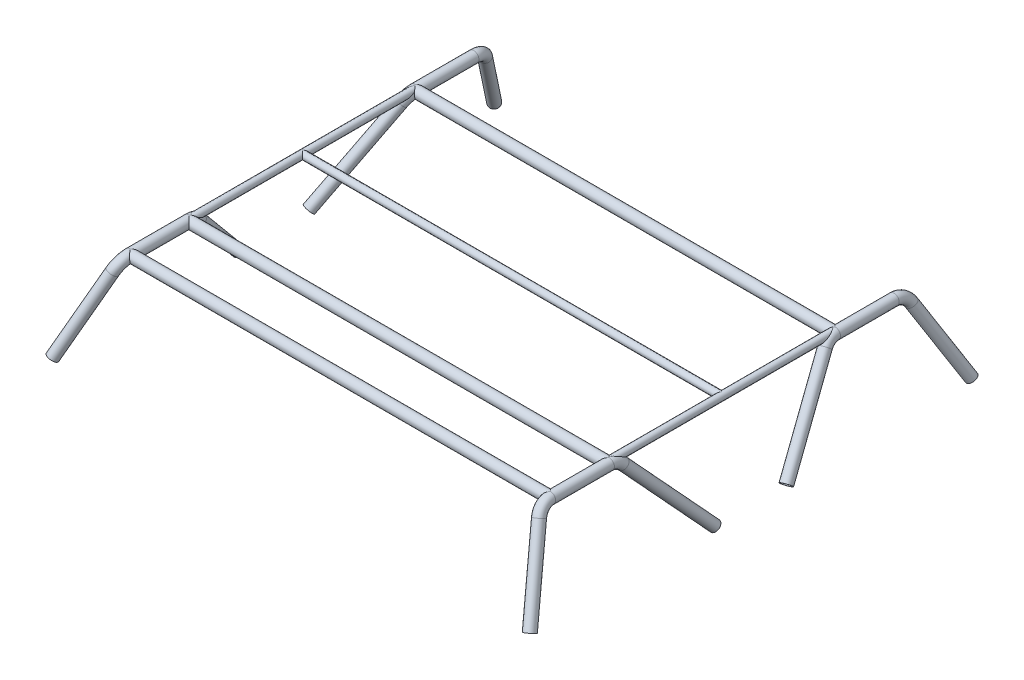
SolidWorks part; units mm, degrees
ref_plane "Front Plane" through (0, 0, 0) normal (0, 0, 1) x (1, 0, 0)
ref_plane "Top Plane" through (0, 0, 0) normal (0, 1, 0) x (1, 0, 0)
ref_plane "Right Plane" through (0, 0, 0) normal (1, 0, 0) x (0, 0, -1)
sketch "Sketch1" plane through (0, 0, 0) normal (0, 0, 1) x (1, 0, 0)
  line L0 (-850.9, 0) -> (850.9, 0) construction
  line L1 (-850.9, 0) -> (-749.2067, 279.4)
  line L2 (-749.2067, 279.4) -> (749.2067, 279.4)
  line L3 (749.2067, 279.4) -> (850.9, 0)
  line L4 (0, 0) -> (0, 279.4) construction
  dimension "D1" = 1701.8
  dimension "D2" = 70
  dimension "D3" = 279.4
extrude "Extrude-Thin1" add sketch "Sketch1" along normal mid plane 1574.8 thin
sketch "Sketch2" plane through (751.3636, 273.474, 0) normal (0.9397, 0.342, 0) x (0, 0, -1)
  line L0 (-787.4, -291.0249) -> (-664.1391, -26.691)
  line L1 (-787.4, 6.3063) -> (787.4, 6.3063) construction
  line L2 (-612.3436, 6.3063) -> (-403.14, 6.3063)
  line L3 (-359.3606, -14.1084) -> (-127, -291.0249)
  line L4 (-787.4, -291.0249) -> (787.4, -291.0249) construction
  line L5 (0, 0) -> (0, -291.0249) construction
  line L6 (359.3606, -14.1084) -> (127, -291.0249)
  line L7 (-787.4, -291.0249) -> (787.4, -291.0249) construction
  line L8 (612.3436, 6.3063) -> (403.14, 6.3063)
  line L9 (787.4, -291.0249) -> (664.1391, -26.691)
  line L10 (-403.14, 6.3063) -> (403.14, 6.3063)
  line L11 (-403.14, 6.3063) -> (-403.14, 12.7579) construction
  line L12 (-403.14, 12.7579) -> (403.14, 12.7579)
  line L13 (403.14, 12.7579) -> (403.14, 6.3063) construction
  arc A0 (-403.14, 6.3063) -> (-359.3606, -14.1084) centre (-403.14, -50.8437) cw
  arc A1 (-664.1391, -26.691) -> (-612.3436, 6.3063) centre (-612.3436, -50.8437) cw
  arc A2 (664.1391, -26.691) -> (612.3436, 6.3063) centre (612.3436, -50.8437) ccw
  arc A3 (403.14, 6.3063) -> (359.3606, -14.1084) centre (403.14, -50.8437) ccw
  point P19 (-376.4906, 6.3063)
  point P22 (-648.7522, 6.3063)
  point P31 (648.7522, 6.3063)
  point P32 (376.4906, 6.3063)
  dimension "D2" = 57.15
  dimension "D1" = 660.4
  dimension "D3" = 65
  dimension "D4" = 50
  dimension "D5" = 6.4516
other "Stainless round tube 1.50 X .065(1)"
ref_plane "Plane1" through (850.9, 0, 787.4) normal (-0.31, 0.8517, -0.4226) x (-0.1445, 0.3971, 0.9063)
sketch "Profile" plane through (850.9, 0, 787.4) normal (-0.31, 0.8517, -0.4226) x (-0.1445, 0.3971, 0.9063)
  circle A0 centre (0, 0) radius 19.05
  circle A1 centre (0, 0) radius 17.399
  point P4 (0, 0)
  dimension "D" = 38.1
  dimension "T" = 1.651
other "Stainless round tube 1.00 X .065(1)"
ref_plane "Plane2" through (747.0001, 285.4625, 403.14) normal (0, 0, -1) x (-0.342, 0.9397, 0)
sketch "Profile1" plane through (747.0001, 285.4625, 403.14) normal (0, 0, -1) x (-0.342, 0.9397, 0)
  circle A0 centre (0, 0) radius 12.7
  circle A1 centre (0, 0) radius 11.049
  point P4 (0, 0)
  dimension "D" = 25.4
  dimension "T" = 1.651
sketch "Sketch8" plane through (0, 0, 403.14) normal (0, 0, 1) x (1, 0, 0)
  line L0 (747.0001, 298.1625) -> (747.0001, 298.3218)
  circle A0 centre (747.0001, 285.4625) radius 12.7 construction
  circle A1 centre (749.2067, 279.4) radius 19.05 construction
  dimension "D1" = 0.1593
sketch "Sketch5" plane through (0, 279.4, 0) normal (0, 1, 0) x (1, 0, 0)
  line L0 (0, -228.6) -> (0, 0) construction
  line L1 (-609.6, -1143) -> (609.6, -1143)
  line L2 (-609.6, -1143) -> (-609.6, 685.8)
  line L3 (-609.6, 685.8) -> (609.6, 685.8)
  line L4 (609.6, -1143) -> (609.6, 685.8)
  line L5 (-609.6, -1143) -> (609.6, 685.8) construction
  line L6 (-609.6, 685.8) -> (609.6, -1143) construction
  line L7 (-749.2067, 787.4) -> (749.2067, 787.4) construction
  point P0 (0, -228.6)
  dimension "D1" = 1828.8
  dimension "D2" = 1219.2
  dimension "D3" = 101.6
sketch "Sketch6" plane through (0, 279.4, 0) normal (0, 1, 0) x (1, 0, 0)
  line L0 (749.2067, -403.14) -> (-609.6, -403.14)
  line L2 (-609.6, -1143) -> (-609.6, 685.8) construction
  line L3 (749.2067, 403.14) -> (-609.6, 403.14)
  line L5 (768.2567, -403.14) -> (730.1567, -403.14) construction
  line L6 (749.2067, -612.3436) -> (-749.2067, -612.3436)
  line L9 (768.2567, -612.3436) -> (730.1567, -612.3436) construction
  line L10 (-749.2067, -787.4) -> (-749.2067, 787.4) construction
other "Stainless round tube 1.50 X .065(4)"
ref_plane "Plane3" through (749.2067, 279.4, 403.14) normal (-1, 0, 0) x (0, 0, 1)
sketch "Profile2" plane through (749.2067, 279.4, 403.14) normal (-1, 0, 0) x (0, 0, 1)
  circle A0 centre (0, 0) radius 19.05
  circle A1 centre (0, 0) radius 17.399
  point P4 (0, 0)
  dimension "D" = 38.1
  dimension "T" = 1.651
other "Trim/Extend1"
other "Trim/Extend2"
other "Trim/Extend3"
mirror "Mirror1" about plane through (0, 0, 0) normal (1, 0, 0)
other "Trim/Extend4"
other "Trim/Extend5"
ref_plane "Mounting Plane" through (0, 25.4, 0) normal (0, 1, 0) x (1, 0, 0)
delete or keep bodies "Body-Delete/Keep 1" type delete bodies bodies 101
ref_plane "Plane4" through (0, 285.4625, 0) normal (0, 1, 0) x (1, 0, 0)
sketch "Sketch9" plane through (0, 285.4625, 0) normal (0, 1, 0) x (1, 0, 0)
  line L0 (-758.0491, 0) -> (759.7001, 0)
  line L1 (-758.0491, 361.0916) -> (-758.0491, -361.0916) construction
  line L2 (759.7001, -362.2464) -> (759.7001, 362.2464) construction
other "Stainless round tube 1.00 X .065(5)"
ref_plane "Plane5" through (-758.0491, 285.4625, 0) normal (1, 0, 0) x (0, 0, -1)
sketch "Profile3" plane through (-758.0491, 285.4625, 0) normal (1, 0, 0) x (0, 0, -1)
  circle A0 centre (0, 0) radius 12.7
  circle A1 centre (0, 0) radius 11.049
  point P4 (0, 0)
  dimension "D" = 25.4
  dimension "T" = 1.651
other "Trim/Extend7"
other "Trim/Extend9"
extrude "Boss-Extrude1" [suppressed] add sketch "Sketch5" along normal blind 254 separate body
